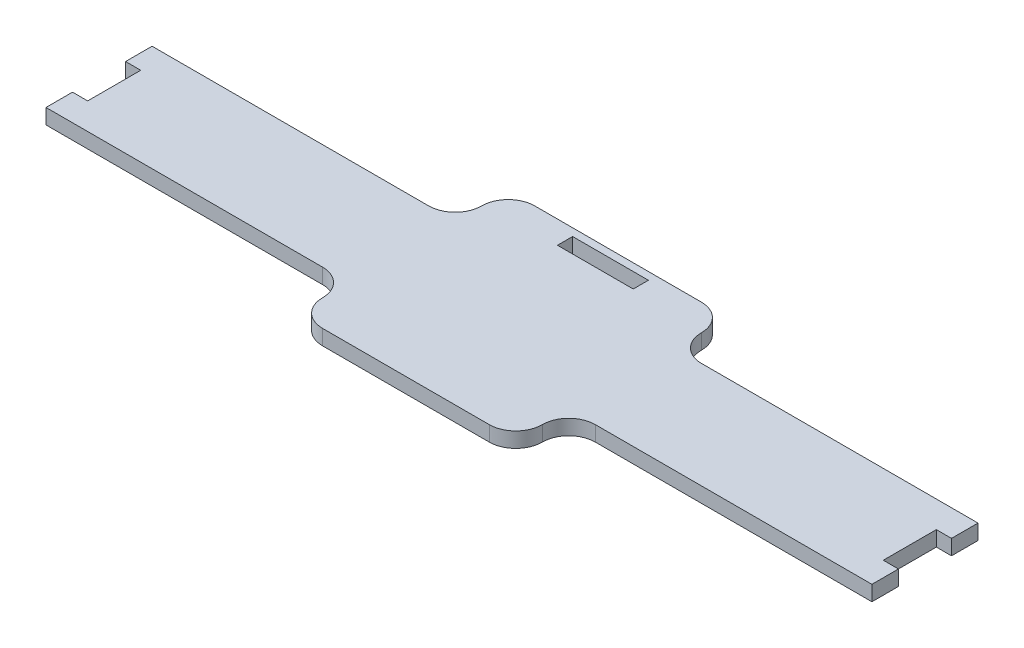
SolidWorks part; units mm, degrees
ref_plane "Front Plane" through (0, 0, 0) normal (0, 0, 1) x (1, 0, 0)
ref_plane "Top Plane" through (0, 0, 0) normal (0, 1, 0) x (1, 0, 0)
ref_plane "Right Plane" through (0, 0, 0) normal (1, 0, 0) x (0, 0, -1)
sketch "Sketch1" plane through (0, 0, 0) normal (0, 1, 0) x (1, 0, 0)
  line L0 (-54.5, 0) -> (54.5, 0) construction
  line L1 (0, 11.2741) -> (0, -11.2741) construction
  line L2 (-14.5, 14) -> (14.5, 14)
  line L3 (14.5, 14) -> (14.5, 7)
  line L4 (14.5, 7) -> (54.5, 7)
  line L5 (54.5, 7) -> (54.5, -7)
  line L6 (-54.5, 7) -> (-54.5, -7)
  line L7 (-14.5, 14) -> (-14.5, 7)
  line L8 (-14.5, 7) -> (-54.5, 7)
  line L9 (-14.5, -7) -> (-54.5, -7)
  line L10 (-14.5, -14) -> (-14.5, -7)
  line L11 (14.5, -7) -> (54.5, -7)
  line L12 (14.5, -14) -> (14.5, -7)
  line L13 (-14.5, -14) -> (14.5, -14)
  line L14 (-52.5, 7) -> (-52.5, -7) construction
  line L15 (-5, 11) -> (5, 11)
  line L16 (-5, 11) -> (-5, 13)
  line L17 (-5, 13) -> (5, 13)
  line L18 (5, 11) -> (5, 13)
  line L19 (-5, 11) -> (5, 13) construction
  line L20 (-5, 13) -> (5, 11) construction
  line L21 (-53.5, 7) -> (-53.5, -7) construction
  line L22 (53.5, 7) -> (53.5, -7) construction
  line L23 (52.5, 7) -> (52.5, -7) construction
  point P3 (0, 0)
  point P6 (0, 0)
  point P7 (0, -14)
  point P14 (0, 14)
  point P21 (0, 12)
  dimension "D1" = 29
  dimension "D2" = 107
  dimension "D3" = 28
  dimension "D4" = 14
  dimension "D5" = 10
  dimension "D6" = 1
  dimension "D7" = 2
  dimension "D8" = 2
  dimension "D9" = 1
extrude "Boss-Extrude1" add sketch "Sketch1" along normal blind 2
sketch "Sketch2" plane through (0, 0, 0) normal (0, 1, 0) x (1, 0, 0)
  line L0 (0, 14) -> (0, -14) construction
  line L1 (14.5, 14) -> (-14.5, 14) construction
  line L2 (-14.5, -14) -> (14.5, -14) construction
  line L12 (-54.5, 7) -> (-54.5, -7) construction
  line L13 (-54.5, -3.5) -> (-52.5, -3.5)
  line L14 (-54.5, -3.5) -> (-54.5, 3.5)
  line L15 (-54.5, 3.5) -> (-52.5, 3.5)
  line L16 (-52.5, -3.5) -> (-52.5, 3.5)
  line L17 (-54.5, 0) -> (54.5, 0) construction
  line L18 (54.5, -7) -> (54.5, 7) construction
  line L19 (52.5, -3.5) -> (52.5, 3.5)
  line L20 (54.5, 3.5) -> (52.5, 3.5)
  line L21 (54.5, -3.5) -> (54.5, 3.5)
  line L22 (54.5, -3.5) -> (52.5, -3.5)
  point P17 (-54.5, 0)
  dimension "D1" = 2
  dimension "D2" = 7
fillet "Fillet1" radius 3.5 8 edges at (-14.5, 1, -7) (-14.5, 1, -14) (14.5, 1, -14) (14.5, 1, -7) (-14.5, 1, 7) (-14.5, 1, 14) (14.5, 1, 14) (14.5, 1, 7)
extrude "Cut-Extrude2" cut sketch "Sketch2" along normal up to surface (2 mm away)
